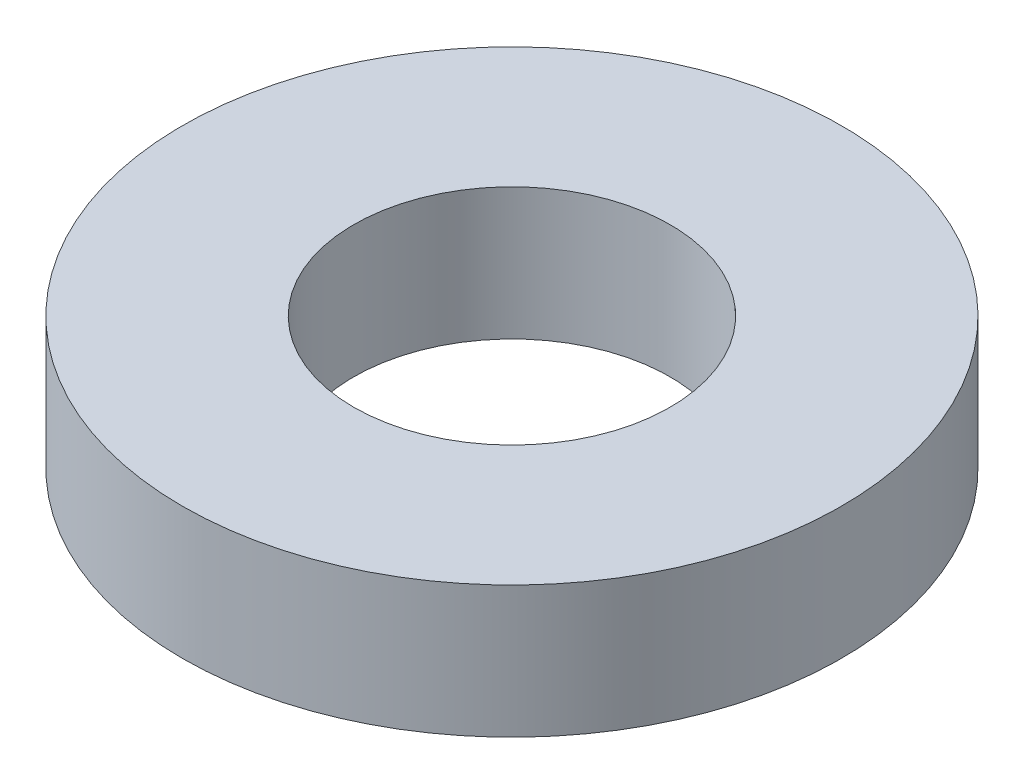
SolidWorks part; units mm, degrees
ref_plane "Plan de face" through (0, 0, 0) normal (0, 0, 1) x (1, 0, 0)
ref_plane "Plan de dessus" through (0, 0, 0) normal (0, 1, 0) x (1, 0, 0)
ref_plane "Plan de droite" through (0, 0, 0) normal (1, 0, 0) x (0, 0, -1)
sketch "Esquisse1" plane through (0, 0, 0) normal (0, 1, 0) x (1, 0, 0)
  circle A0 centre (0, 0) radius 50
  circle A1 centre (0, 0) radius 24
  dimension "D1" = 100
  dimension "D2" = 48
extrude "Extrusion1" add sketch "Esquisse1" along normal blind 20
